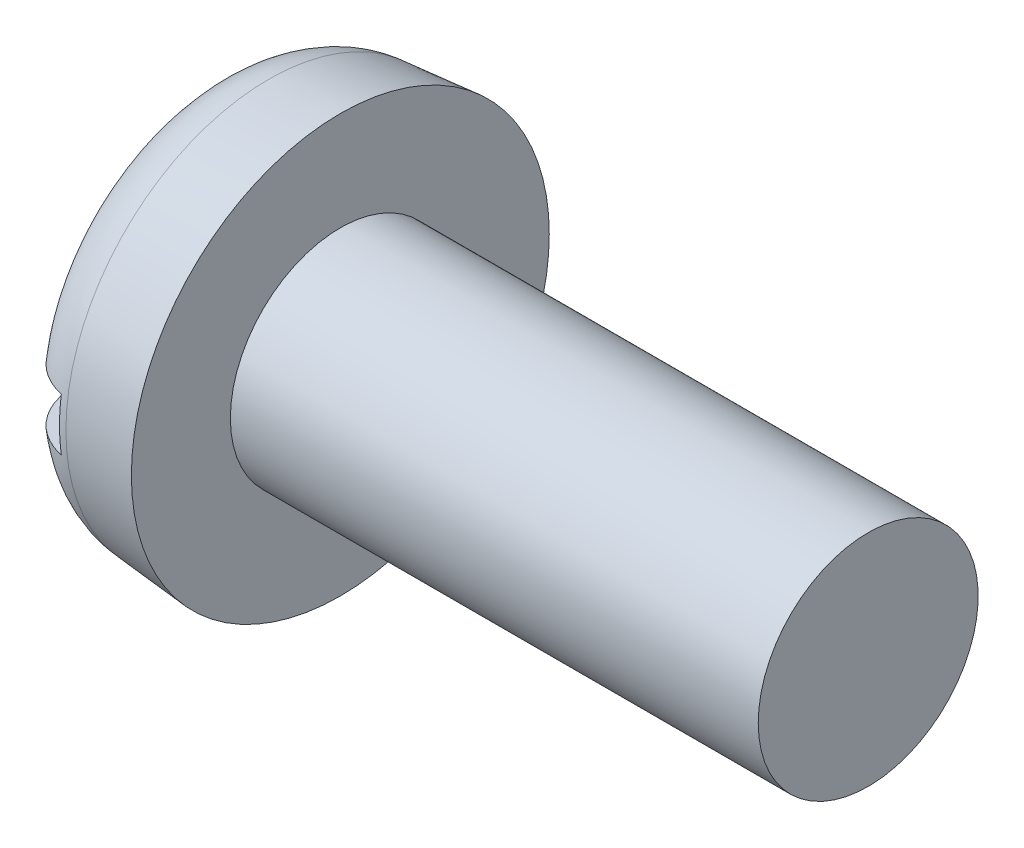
SolidWorks part; units mm, degrees
ref_plane "Plane1" through (0, 0, 0) normal (0, 0, 1) x (1, 0, 0)
ref_plane "Plane2" through (0, 0, 0) normal (0, 1, 0) x (1, 0, 0)
ref_plane "Plane3" through (0, 0, 0) normal (1, 0, 0) x (0, 0, -1)
sketch "BodySke" plane through (0, 0, 0) normal (0, 0, 1) x (1, 0, 0)
  line L0 (3, 2.5) -> (3, 4.75)
  line L1 (0, 0) -> (0, 4.4875)
  line L2 (-25.4, 0) -> (127, 0) construction
  line L3 (15, 0) -> (0, 0)
  line L4 (3, 2.5) -> (15, 2.5)
  line L5 (15, 2.5) -> (15, 0)
  line L6 (0, 4.4875) -> (3, 4.75)
  line L9 (3.8, 4.0875) -> (3.8, -5.4375) construction
  line L10 (3, 6.35) -> (3, -3.175) construction
  dimension "Head_ht" = 3
  dimension "Diameter" = 5
  dimension "Length" = 12
  dimension "Head_dia" = 9.5
  dimension "Advance" = 0.8
  dimension "Thread_nom" = 12
  dimension "Head_side_angle" = 5
revolve "Base-Revolve" add sketch "BodySke"
fillet "Fillet1" [suppressed] radius 0.2
fillet "Fillet2" radius 1.5 1 edges at (0, 0, 4.4875)
sketch "Sketch2" plane through (0, 0, 0) normal (1, 0, 0) x (0, 0, -1)
  line L0 (4.75, -0.6) -> (-4.75, -0.6)
  line L1 (4.75, -0.6) -> (4.75, 0.6)
  line L2 (-4.75, 0.6) -> (4.75, 0.6)
  line L3 (-4.75, 0.6) -> (-4.75, -0.6)
  dimension "D1" = 9.5
  dimension "D2" = 4.75
  dimension "Slot_width" = 1.2
  dimension "D3" = 0.6
extrude "Slot" cut sketch "Sketch2" along normal blind 1.2
sketch "ThdSchSke" plane through (0, 0, 0) normal (0, 0, 1) x (1, 0, 0)
  line L0 (4.6, -2.055) -> (4.2884, -2.5)
  line L1 (4.6, -2.055) -> (4.9116, -2.5)
  line L2 (4.9116, -2.5) -> (4.9116, -3.125)
  line L3 (-3.175, 0) -> (5.1513, 0) construction
  line L5 (4.9116, -3.125) -> (4.2884, -3.125)
  line L6 (4.2884, -3.125) -> (4.2884, -2.5)
  dimension "Thread_minor" = 4.11
  dimension "Diameter" = 5
  dimension "Start" = 4.6
  dimension "SideAngle" = 55
  dimension "VeeAngle" = 70
  dimension "Overcut" = 6.25
revolve "ThreadSchematic" [suppressed] cut sketch "ThdSchSke" angle 360 about L3
pattern_linear "ThdSchPat" [suppressed]
equation "\"D1@Sketch2\" = \"Head_dia@BodySke\""
equation "\"D2@Sketch2\" = \"D1@Sketch2\" / 2"
equation "\"D3@Sketch2\" = \"Slot_width@Sketch2\" / 2"
equation "\"Thread_length@ThreadCosmetic\" = ((sgn( (\"Length@BodySke\" - \"Advance@BodySke\" * 2.0 ) - \"Thread_nom@BodySke\" )-1)*( (\"Length@BodySke\" - \"Advance@BodySke\"  * 2.0) - \"Thread_nom@BodySke\" ))/-2+ \"Thread_"
equation "\"Thread_minor@ThdSchSke\" = \"Thread_minor@ThreadCosmetic\""
equation "\"Diameter@ThdSchSke\" = \"Diameter@BodySke\""
equation "\"Overcut@ThdSchSke\" = \"Diameter@BodySke\" * 1.25"
equation "\"Start@ThdSchSke\" = \"Head_ht@BodySke\" + \"Length@BodySke\" - \"Thread_length@ThreadCosmetic\"  '---Non-countersunk---"
equation "\"Num_threads@ThdSchPat\" = int( \"Thread_length@ThreadCosmetic\" / \"Advance@BodySke\" + 0.999 )  + 1"
equation "\"Advance@ThdSchPat\" = \"Thread_length@ThreadCosmetic\" /  (\"Num_threads@ThdSchPat\" - 1) 'relax it"
